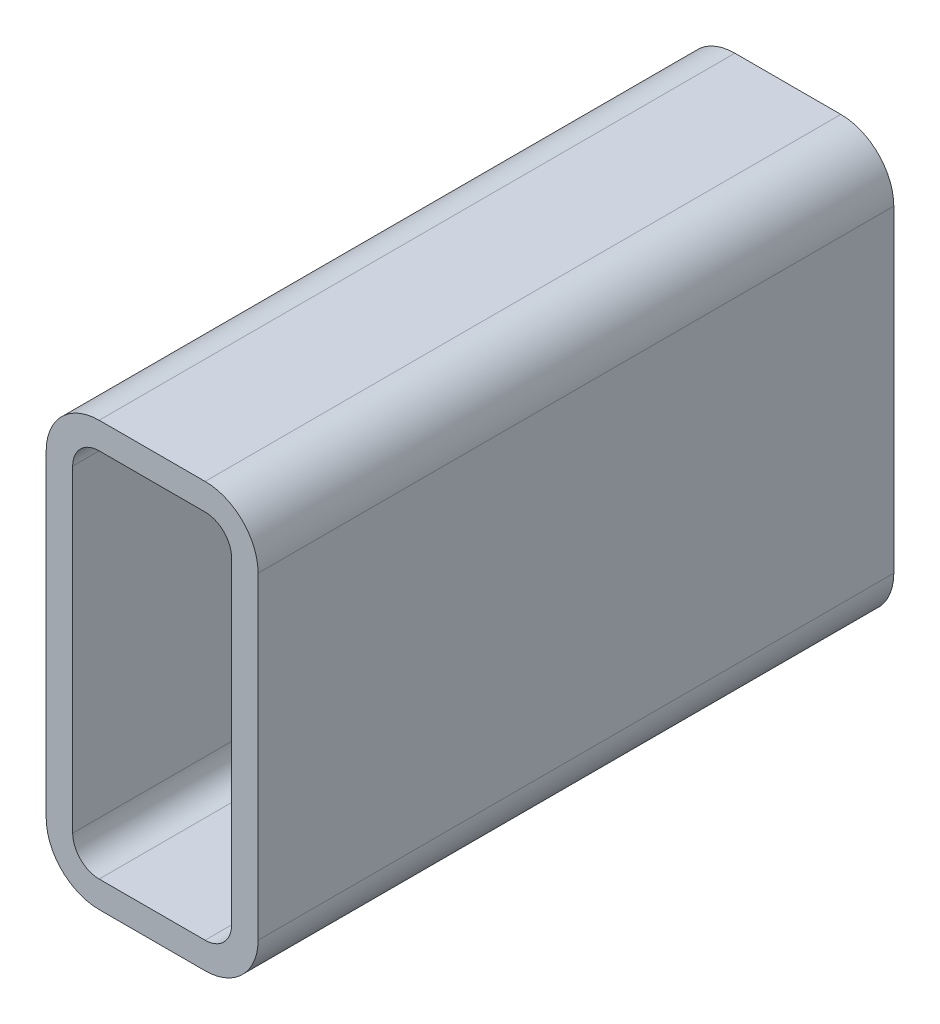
SolidWorks part; units mm, degrees
ref_plane "Front Plane" through (0, 0, 0) normal (0, 0, 1) x (1, 0, 0)
ref_plane "Top Plane" through (0, 0, 0) normal (0, 1, 0) x (1, 0, 0)
ref_plane "Right Plane" through (0, 0, 0) normal (1, 0, 0) x (0, 0, -1)
sketch "Sketch1" plane through (0, 0, 0) normal (0, 0, 1) x (1, 0, 0)
sketch_block_instance "HSS8x4x0.500-1"
sketch_block "HSS8x4x0.500"
extrude "Boss-Extrude1" add sketch "Sketch1" along normal blind 304.8
